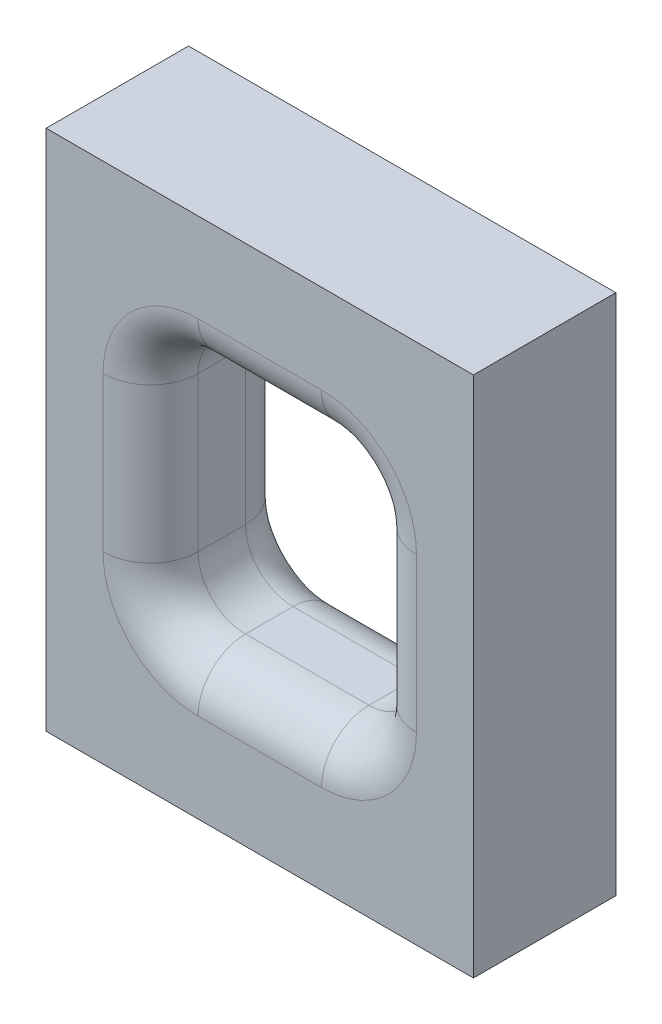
SolidWorks part; units mm, degrees
ref_plane "Front Plane" through (0, 0, 0) normal (0, 0, 1) x (1, 0, 0)
ref_plane "Top Plane" through (0, 0, 0) normal (0, 1, 0) x (1, 0, 0)
ref_plane "Right Plane" through (0, 0, 0) normal (1, 0, 0) x (0, 0, -1)
sketch "Sketch1" plane through (0, 0, 0) normal (0, 0, 1) x (1, 0, 0)
  line L0 (4.5, -4.5) -> (4.5, -5.5)
  line L1 (-1.3, 2.625) -> (1.3, 2.625)
  line L2 (-2.3, 1.625) -> (-2.3, -1.625)
  line L3 (-1.3, -2.625) -> (1.3, -2.625)
  line L4 (2.3, 1.625) -> (2.3, -1.625)
  line L5 (-2.3, 2.625) -> (2.3, -2.625) construction
  line L6 (-2.3, -2.625) -> (2.3, 2.625) construction
  line L7 (-3.5, 5.5) -> (3.5, 5.5)
  line L8 (-4.5, 4.5) -> (-4.5, -4.5)
  line L9 (-4.5, -5.5) -> (4.5, -5.5)
  line L10 (4.5, 4.5) -> (4.5, -4.5)
  line L11 (-4.5, 5.5) -> (4.5, -5.5) construction
  line L12 (-4.5, -5.5) -> (4.5, 5.5) construction
  line L15 (-4.5, -5.5) -> (-4.5, -4.5)
  line L17 (-4.5, 4.5) -> (-4.5, 5.5)
  line L18 (-4.5, 5.5) -> (-3.5, 5.5)
  line L19 (3.5, 5.5) -> (4.5, 5.5)
  line L20 (4.5, 5.5) -> (4.5, 4.5)
  arc A0 (1.3, 2.625) -> (2.3, 1.625) centre (1.3, 1.625) cw
  arc A1 (1.3, -2.625) -> (2.3, -1.625) centre (1.3, -1.625) ccw
  arc A2 (-2.3, -1.625) -> (-1.3, -2.625) centre (-1.3, -1.625) ccw
  arc A3 (-1.3, 2.625) -> (-2.3, 1.625) centre (-1.3, 1.625) ccw
  point P0 (0, 0)
  point P5 (0, 0)
  dimension "D1" = 1
extrude "Boss-Extrude1" add sketch "Sketch1" along normal blind 3
fillet "Fillet3" radius 1 16 edges at (2.0071, -2.3321, 0) (0, -2.625, 0) (-2.0071, -2.3321, 0) (-2.3, 0, 0) (-2.0071, 2.3321, 0) (0, 2.625, 0) (2.0071, 2.3321, 0) (2.0071, -2.3321, 3) (0, -2.625, 3) (-2.0071, -2.3321, 3) (-2.3, 0, 3) (-2.0071, 2.3321, 3) (0, 2.625, 3) (2.3, 0, 3) (2.3, 0, 0) (2.0071, 2.3321, 3)
